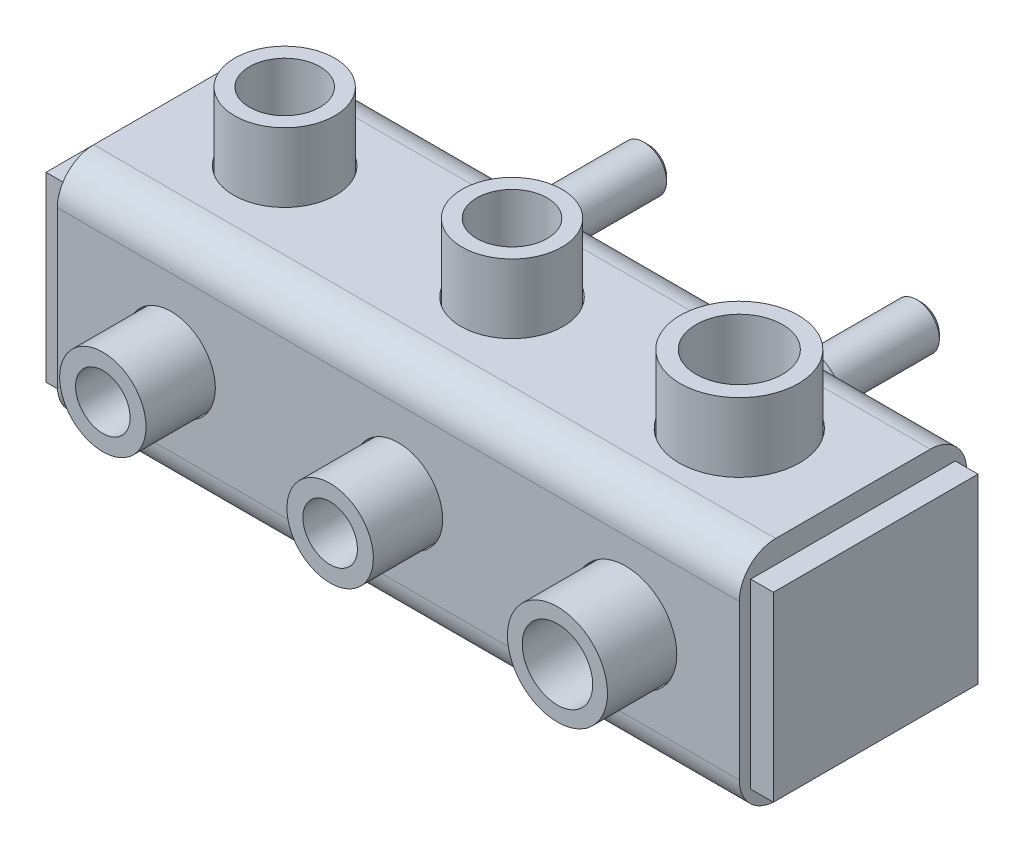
SolidWorks part; units mm, degrees
ref_plane "Plan de face" through (0, 0, 0) normal (0, 0, 1) x (1, 0, 0)
ref_plane "Plan de dessus" through (0, 0, 0) normal (0, 1, 0) x (1, 0, 0)
ref_plane "Plan de droite" through (0, 0, 0) normal (1, 0, 0) x (0, 0, -1)
sketch "Esquisse1" plane through (0, 0, 0) normal (0, 1, 0) x (1, 0, 0)
  line L0 (-75, 0) -> (75, 0)
  dimension "D1" = 150
other "Elément mécano-soudé1"
ref_plane "Plan1" through (-75, 0, 0) normal (1, 0, 0) x (0, 0, -1)
sketch "Sketch1" plane through (-75, 0, 0) normal (1, 0, 0) x (0, 0, -1)
  line L0 (-17, -20) -> (17, -20)
  line L1 (-20, -17) -> (-20, 17)
  line L2 (17, 20) -> (-17, 20)
  line L3 (20, 17) -> (20, -17)
  line L4 (-17, -25) -> (17, -25)
  line L5 (-25, -17) -> (-25, 17)
  line L6 (17, 25) -> (-17, 25)
  line L7 (25, 17) -> (25, -17)
  arc A0 (25, 17) -> (17, 25) centre (17, 17) ccw
  arc A1 (17, -25) -> (25, -17) centre (17, -17) ccw
  arc A2 (-25, -17) -> (-17, -25) centre (-17, -17) ccw
  arc A3 (-17, 25) -> (-25, 17) centre (-17, 17) ccw
  arc A4 (-17, 20) -> (-20, 17) centre (-17, 17) ccw
  arc A5 (20, 17) -> (17, 20) centre (17, 17) ccw
  arc A6 (17, -20) -> (20, -17) centre (17, -17) ccw
  arc A7 (-20, -17) -> (-17, -20) centre (-17, -17) ccw
  point P0 (-25, 0)
  point P1 (25, 0)
  point P2 (0, 25)
  point P3 (0, -25)
  point P4 (0, 0)
  point P5 (-25, -25)
  point P6 (25, -25)
  point P7 (25, 25)
  point P8 (-25, 25)
  point P33 (0, 0)
  dimension "D1" = 8
  dimension "Thickness" = 5
  dimension "V_leg" = 50
sketch "Esquisse3" plane through (75, 0, 0) normal (1, 0, 0) x (0, 0, -1)
  line L0 (-22.5, 0) -> (22.5, 0)
  dimension "D1" = 45
other "Elément mécano-soudé2"
ref_plane "Plan2" through (75, 0, 22.5) normal (0, 0, -1) x (-1, 0, 0)
sketch "Esquisse11" plane through (80, 20, 22.5) normal (0, 0, -1) x (0, -1, 0)
  line L0 (20, 5) -> (20, 0) construction
  line L1 (0, 0) -> (40, 0)
  line L2 (0, 0) -> (0, 5)
  line L3 (0, 5) -> (40, 5)
  line L4 (40, 0) -> (40, 5)
  line L5 (40, 2.5) -> (0, 2.5) construction
  point P9 (0, 0)
  dimension "D1" = 40
  dimension "D2" = 5
mirror "Symétrie1" about plane through (0, 0, 0) normal (1, 0, 0)
hole_wizard "Diamètre du perçage Ø22.5 (22.5)1" positions "Esquisse3D2" profile "Esquisse13" hole size "Ø22.5" standard "ISO"
sketch3d "Esquisse3D2"
  line L1 (50, 17, 25) -> (50, -17, 25) construction
  line L2 (75, 17, 25) -> (-75, 17, 25) construction
  line L3 (75, -17, 25) -> (-75, -17, 25) construction
  line L5 (0, 25, -17) -> (0, 25, 17) construction
  line L6 (75, 25, -17) -> (-75, 25, -17) construction
  line L7 (75, 25, 17) -> (-75, 25, 17) construction
  line L9 (-50, 25, 17) -> (-50, 25, -17) construction
  line L11 (-75, 25, -17) -> (-75, 25, 17) construction
  line L12 (75, 17, 25) -> (75, -17, 25) construction
  point P0 (-50, 25, 0)
  point P2 (0, 25, 0)
  point P4 (50, 0, 25)
  dimension "D1" = 25
  dimension "D2" = 50
  dimension "D3" = 25
sketch "Esquisse13" plane through (-50, 25, 0) normal (1, 0, 0) x (0, 0, 1)
  line L0 (0, 0) -> (0, 5)
  line L1 (0, 5) -> (11.25, 5)
  line L2 (11.25, 5) -> (11.25, 0)
  line L5 (11.25, 0) -> (0, 0)
  line L11 (0, -6.35) -> (0, 107.95) construction
  dimension "Diamètre du perçage jusqu'au prochain" = 22.5
  dimension "Profondeur du perçage jusqu'au prochain" = 5
inserted part "manchon à souder 3-8°"
move or copy body "Corps-Déplacer/Copier2" placed by mates yes
other "Distance1" parameters "D1"=15
other "<manchon à souder 3-8°>-<Extrusion1>"
inserted part "manchon à souder 3-8°2"
move or copy body "Corps-Déplacer/Copier4" placed by mates yes
other "<manchon à souder 3-8°>-<Extrusion1>"
inserted part "manchon à souder 3-8°3"
move or copy body "Corps-Déplacer/Copier6" placed by mates yes
other "Distance2" parameters "D1"=15
other "<manchon à souder 3-8°>-<Extrusion1>"
sketch "Esquisse14" plane through (0, 25, 0) normal (0, 1, 0) x (-1, 0, 0)
  line L0 (75, 0) -> (-75, 0) construction
  circle A0 centre (-50, 0) radius 13.25
  dimension "D1" = 26.5
  dimension "D2" = 50
extrude "Enlèv. mat.-Extru.1" cut sketch "Esquisse14" against normal up to next
hole_wizard "Diamètre du perçage Ø19.5 (19.5)1" positions "Esquisse3D3" profile "Esquisse15" hole size "Ø19.5" standard "ISO"
sketch3d "Esquisse3D3"
  line L0 (0, -17, 25) -> (0, 17, 25) construction
  line L1 (75, -17, 25) -> (-75, -17, 25) construction
  line L2 (75, 17, 25) -> (-75, 17, 25) construction
  line L4 (-50, -17, 25) -> (-50, 17, 25) construction
  line L6 (-75, 17, 25) -> (-75, -17, 25) construction
  point P0 (0, 0, 25)
  point P2 (-50, 0, 25)
  dimension "D1" = 25
  dimension "D2" = 50
sketch "Esquisse15" plane through (0, 0, 25) normal (1, 0, 0) x (0, -1, 0)
  line L0 (0, 0) -> (0, 5)
  line L1 (0, 5) -> (9.75, 5)
  line L2 (9.75, 5) -> (9.75, 0)
  line L5 (9.75, 0) -> (0, 0)
  line L11 (0, -6.35) -> (0, 107.95) construction
  dimension "Diamètre du perçage jusqu'au prochain" = 19.5
  dimension "Profondeur du perçage jusqu'au prochain" = 5
inserted part "manchon à souder 1-4°"
move or copy body "Corps-Déplacer/Copier8" placed by mates yes
other "Distance3" parameters "D1"=15
other "<manchon à souder 1-4°>-<Extrusion1>"
inserted part "manchon à souder 1-4°2"
move or copy body "Corps-Déplacer/Copier10" placed by mates yes
other "<manchon à souder 1-4°>-<Extrusion1>"
inserted part "manchon à souder 1-2°"
move or copy body "Corps-Déplacer/Copier12" placed by mates yes
other "Distance4" parameters "D1"=15
other "<manchon à souder 1-2°>-<Extrusion1>"
sketch "Esquisse17" plane through (0, 0, -25) normal (0, 0, -1) x (-1, 0, 0)
  line L0 (-30, 17) -> (-30, -17) construction
  line L1 (-75, 17) -> (75, 17) construction
  line L2 (-75, -17) -> (75, -17) construction
  line L3 (-75, 5) -> (-30, 5) construction
  line L4 (-75, -17) -> (-75, 17) construction
  line L5 (-75, 25) -> (75, 25) construction
  line L6 (0, 17) -> (0, -17) construction
  line L7 (75, 5) -> (30, 5) construction
  line L8 (30, 17) -> (30, -17) construction
  dimension "D1" = 45
  dimension "D2" = 20
ref_point "Point2"
ref_point "Point3"
inserted part "vis CHC M10 x 25"
move or copy body "Corps-Déplacer/Copier14" placed by mates yes
other "<vis CHC M10 x 25>-<Enlèv. mat.-Extru.1>"
inserted part "vis CHC M10 x 254"
move or copy body "Corps-Déplacer/Copier16" placed by mates yes
other "<vis CHC M10 x 25>-<Enlèv. mat.-Extru.1>"
